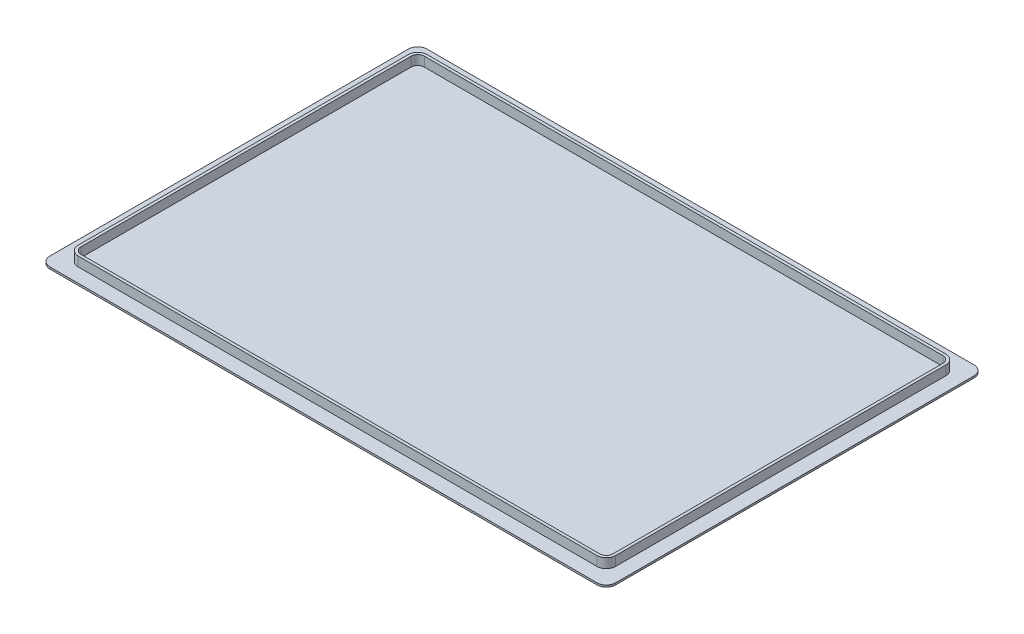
SolidWorks part; units mm, degrees
ref_plane "Ebene vorne" through (0, 0, 0) normal (0, 0, 1) x (1, 0, 0)
ref_plane "Ebene oben" through (0, 0, 0) normal (0, 1, 0) x (1, 0, 0)
ref_plane "Ebene rechts" through (0, 0, 0) normal (1, 0, 0) x (0, 0, -1)
sketch "Skizze1" plane through (0, 0, 0) normal (0, 1, 0) x (1, 0, 0)
  line L1 (-290, -200) -> (290, -200)
  line L2 (-300, -190) -> (-300, 190)
  line L3 (-290, 200) -> (290, 200)
  line L4 (300, -190) -> (300, 190)
  line L5 (-300, -200) -> (300, 200) construction
  line L6 (-300, 200) -> (300, -200) construction
  arc A0 (300, -190) -> (290, -200) centre (290, -190) cw
  arc A1 (-300, -190) -> (-290, -200) centre (-290, -190) ccw
  arc A2 (300, 190) -> (290, 200) centre (290, 190) ccw
  arc A3 (-290, 200) -> (-300, 190) centre (-290, 190) ccw
  point P0 (0, 0)
  dimension "D3" = 10
  dimension "D1" = 600
  dimension "D2" = 400
extrude "Aufsatz-Linear austragen1" add sketch "Skizze1" along normal blind 2
sketch "Skizze2" plane through (0, 2, 0) normal (0, 1, 0) x (1, 0, 0)
  line L8 (285, -185) -> (285, 185)
  line L9 (285, 185) -> (-285, 185)
  line L10 (-285, 185) -> (-285, -185)
  line L11 (-285, -185) -> (285, -185)
  line L12 (285, -175) -> (285, 175)
  line L13 (275, 185) -> (-275, 185)
  line L14 (-285, 175) -> (-285, -175)
  line L15 (-275, -185) -> (275, -185)
  arc A4 (275, 185) -> (285, 175) centre (275, 175) cw
  arc A5 (285, -175) -> (275, -185) centre (275, -175) cw
  arc A6 (-275, -185) -> (-285, -175) centre (-275, -175) cw
  arc A7 (-275, 185) -> (-285, 175) centre (-275, 175) ccw
  dimension "D2" = 10
  dimension "D1" = 15
extrude "Linear-Austragen-Dünn1" add sketch "Skizze2" along normal blind 10 thin
